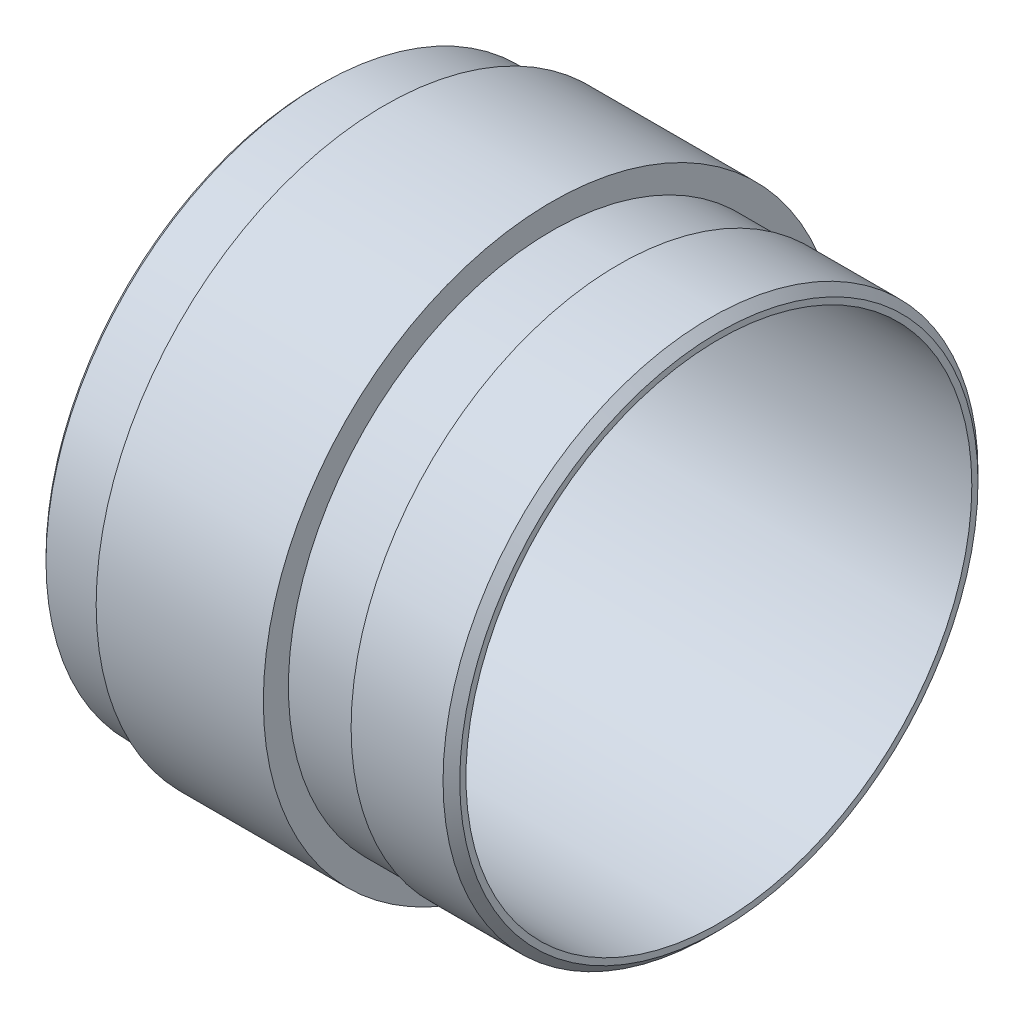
SolidWorks part; units mm, degrees
ref_plane "Front Plane" through (0, 0, 0) normal (0, 0, 1) x (1, 0, 0)
ref_plane "Top Plane" through (0, 0, 0) normal (0, 1, 0) x (1, 0, 0)
ref_plane "Right Plane" through (0, 0, 0) normal (1, 0, 0) x (0, 0, -1)
sketch "Sketch1" plane through (0, 0, 0) normal (1, 0, 0) x (0, 0, -1)
  circle A0 centre (0, 0) radius 109.5375
  circle A1 centre (0, 0) radius 96.0755
  dimension "D1" = 219.075
  dimension "D2" = 192.151
extrude "Boss-Extrude1" add sketch "Sketch1" along normal blind 152.4
sketch "Sketch2" plane through (0, 0, 0) normal (0, 1, 0) x (1, 0, 0)
  line L0 (152.4, -109.5375) -> (152.4, 109.5375) construction
  line L1 (88.9, 113.9613) -> (114.3, 113.9613)
  line L2 (88.9, 113.9613) -> (88.9, 106.9049)
  line L3 (88.9, 106.9049) -> (114.3, 106.9049)
  line L4 (114.3, 113.9613) -> (114.3, 106.9049)
  line L5 (0, 0) -> (-40.8485, 0) construction
  dimension "D1" = 25.4
  dimension "D2" = 38.1
revolve "Cut-Revolve1" cut sketch "Sketch2" angle 360 about L5
sketch "Sketch3" plane through (0, 0, 0) normal (-1, 0, 0) x (0, 0, 1)
  circle A0 centre (0, 0) radius 104.775
  circle A1 centre (0, 0) radius 112.403
  dimension "D1" = 209.55
extrude "Cut-Extrude1" cut sketch "Sketch3" against normal blind 12.7
chamfer "Chamfer2" distance 1.5875 angle 45 1 edges at (0, 0, 104.775)
sketch "Sketch4" plane through (152.4, 0, 0) normal (1, 0, 0) x (0, 0, -1)
  circle A0 centre (0, 0) radius 101.6
  circle A1 centre (0, 0) radius 123.2531
  dimension "D1" = 203.2
extrude "Cut-Extrude2" cut sketch "Sketch4" against normal up to surface (63.5 mm away)
chamfer "Chamfer3" distance 3.175 angle 45 1 edges at (152.4, 0, -101.6)
sketch "Sketch5" plane through (88.9, 0, 0) normal (1, 0, 0) x (0, 0, -1)
  circle A0 centre (0, 0) radius 100.0125
  circle A1 centre (0, 0) radius 118.4883
  dimension "D1" = 200.025
extrude "Cut-Extrude3" cut sketch "Sketch5" along normal blind 25.4
sketch "Sketch7" plane through (12.7, 0, 0) normal (-1, 0, 0) x (0, 0, 1)
  circle A0 centre (0, 0) radius 104.775
  circle A1 centre (0, 0) radius 112.5221
  dimension "D1" = 209.55
extrude "supt ring cut" cut sketch "Sketch7" against normal blind 12.7
